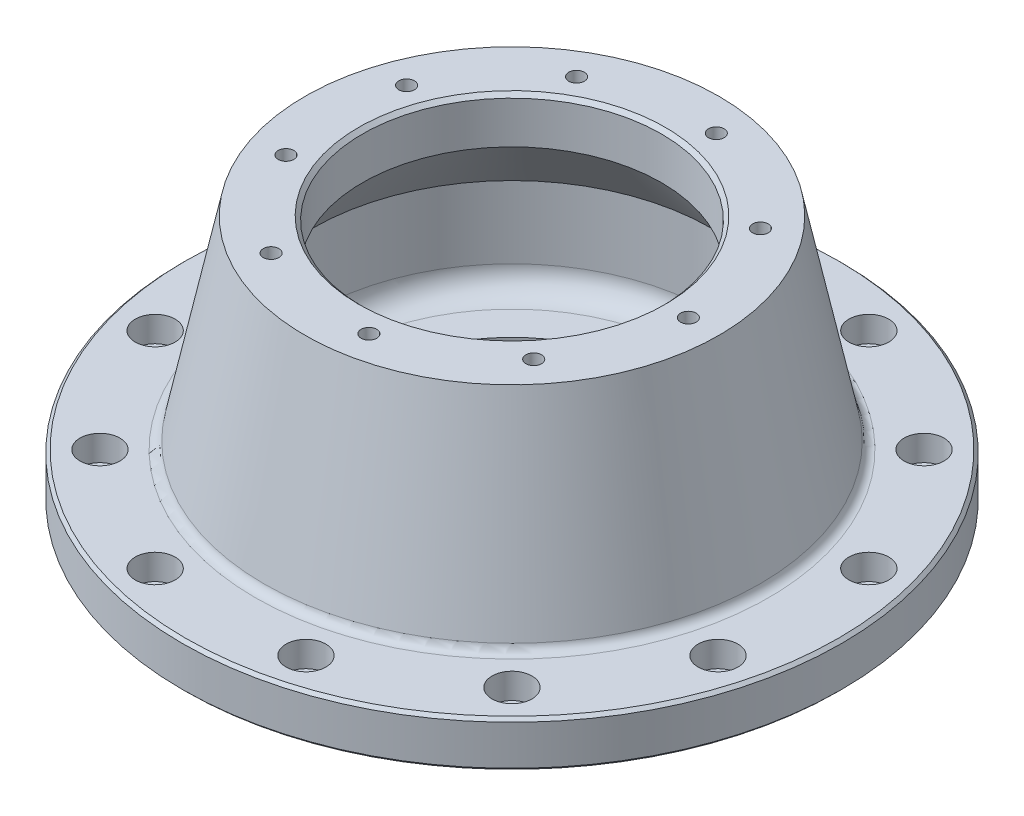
SolidWorks part; units mm, degrees
ref_plane "Front" through (0, 0, 0) normal (0, 0, 1) x (1, 0, 0)
ref_plane "Top" through (0, 0, 0) normal (0, 1, 0) x (1, 0, 0)
ref_plane "Right" through (0, 0, 0) normal (1, 0, 0) x (0, 0, -1)
sketch "Sketch1" plane through (0, 0, 0) normal (0, 0, 1) x (1, 0, 0)
  line L0 (80, 0) -> (215, 0)
  line L1 (215, 0) -> (215, 30)
  line L2 (215, 30) -> (162.5, 30)
  line L3 (162.5, 30) -> (135, 162)
  line L4 (135, 162) -> (97.5, 162)
  line L5 (97.5, 162) -> (97.5, 132)
  line L6 (97.5, 132) -> (130, 90)
  line L7 (130, 90) -> (130, 28)
  line L8 (130, 28) -> (92.5, 28)
  line L9 (92.5, 28) -> (92.5, 15)
  line L10 (92.5, 15) -> (80, 15)
  line L11 (80, 15) -> (80, 0)
  line L12 (0, 0) -> (0, 116.7213) construction
  dimension "D1" = 160
  dimension "D2" = 430
  dimension "D3" = 195
  dimension "D4" = 185
  dimension "D5" = 260
  dimension "D6" = 270
  dimension "D7" = 325
  dimension "D8" = 30
  dimension "D9" = 15
  dimension "D10" = 28
  dimension "D11" = 90
  dimension "D12" = 162
  dimension "D13" = 30
revolve "Revolve1" add sketch "Sketch1" angle 360 about L12
fillet "Fillet1" radius 6 1 edges at (0, 30, -162.5)
hole_wizard "CBORE for M16 Hex Socket Head Cap Screw1" positions "Sketch5" profile "Sketch4" counterbore size "M16" standard "ISO"
sketch "Sketch5" plane through (0, 30, 0) normal (0, 1, 0) x (1, 0, 0)
  line L0 (0, 190) -> (0, 0) construction
  line L1 (0, 0) -> (49.1756, 183.5259) construction
  circle A0 centre (0, 0) radius 190 construction
  point P0 (49.1756, 183.5259)
  dimension "D2" = 380
  dimension "D1" = 15
sketch "Sketch4" plane through (49.1756, 30, -183.5259) normal (1, 0, 0) x (0, 0, 1)
  line L0 (0, 0) -> (0, 30)
  line L1 (0, 30) -> (8.75, 30)
  line L3 (8.75, 30) -> (8.75, 16.6)
  line L4 (8.75, 16.6) -> (13, 16.6)
  line L5 (13, 16.6) -> (13, 0)
  line L7 (13, 0) -> (0, 0)
  line L11 (0, -6.35) -> (0, 107.95) construction
  dimension "Thru Hole Dia." = 17.5
  dimension "Thru Hole Depth" = 30
  dimension "C'Bore Dia." = 26
  dimension "C'Bore Depth" = 16.6
pattern_circular "CirPattern2" count 12 over 360 about axis through (0, 0, 0) along (0, 1, 0) of "CBORE for M16 Hex Socket Head Cap Screw1"
chamfer "Chamfer1" distance 1.8 angle 45 2 edges at (0, 15, -80) (0, 0, -80)
chamfer "Chamfer2" distance 2.5 angle 45 1 edges at (0, 162, -97.5)
hole_wizard "M12 Tapped Hole1" positions "Sketch8" profile "Sketch9" tap size "M12" standard "ISO"
sketch "Sketch8" plane through (0, 162, 0) normal (0, 1, 0) x (1, 0, 0)
  line L0 (0, 0) -> (115, 0) construction
  circle A0 centre (0, 0) radius 115 construction
  point P0 (115, 0)
  dimension "D1" = 230
sketch "Sketch9" plane through (115, 162, 0) normal (1, 0, 0) x (0, 0, 1)
  line L0 (0, 0) -> (0, 35.0644)
  line L1 (0, 35.0644) -> (5.1, 32)
  line L2 (5.1, 32) -> (5.1, 0)
  line L5 (5.1, 0) -> (0, 0)
  line L10 (0, 35.0644) -> (-5.1, 32) construction
  line L11 (0, -6.35) -> (0, 107.95) construction
  dimension "Tap Drill Dia." = 10.2
  dimension "Tap Drill Depth" = 32
  dimension "Drill Angle" = 118
fillet "Fillet2" radius 15 1 edges at (0, 28, -130)
chamfer "Chamfer3" distance 2 angle 45 2 edges at (0, 30, -215) (0, 0, -215)
pattern_circular "CirPattern3" count 9 over 360 about axis through (0, 0, 0) along (0, 1, 0) of "M12 Tapped Hole1"
